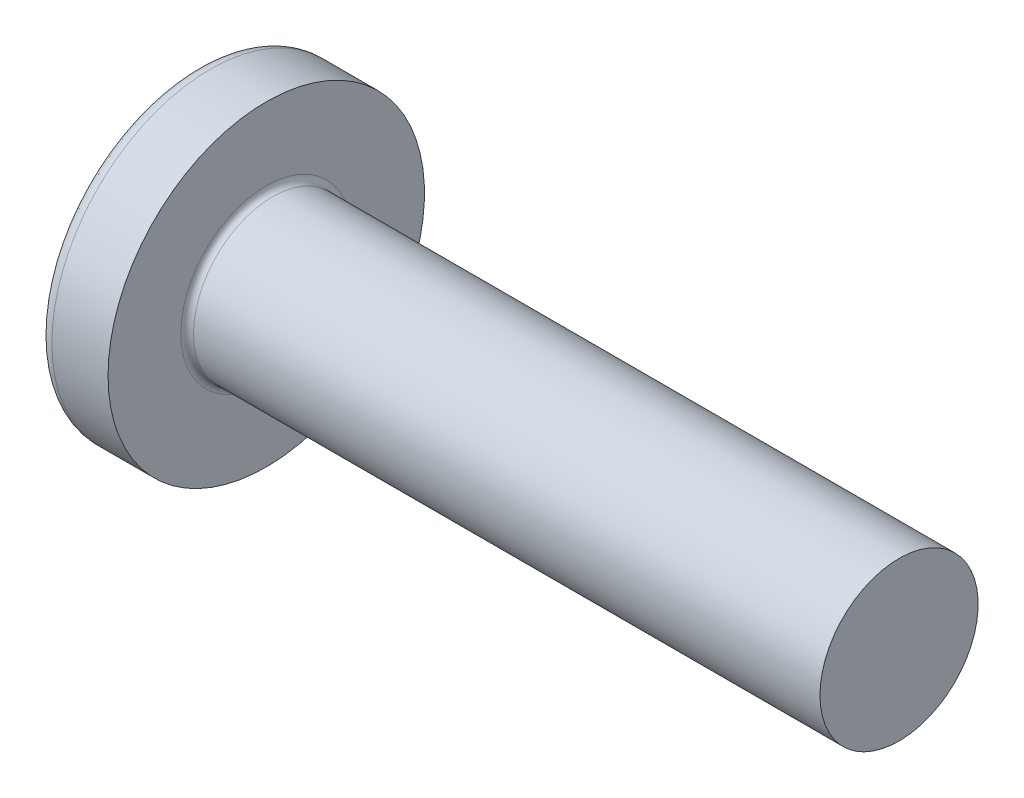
SolidWorks part; units mm, degrees
ref_plane "Plane1" through (0, 0, 0) normal (0, 0, 1) x (1, 0, 0)
ref_plane "Plane2" through (0, 0, 0) normal (0, 1, 0) x (1, 0, 0)
ref_plane "Plane3" through (0, 0, 0) normal (1, 0, 0) x (0, 0, -1)
revolve "Base-Revolve" add sketch "BodySke"
sketch "BodySke" plane through (0, 0, 0) normal (0, 0, 1) x (1, 0, 0)
  line L0 (7.5, 5) -> (7.5, 10)
  line L1 (8.25, 6.35) -> (8.25, -3.175) construction
  line L2 (-25.4, 0) -> (127, 0) construction
  line L3 (47.5, 0) -> (0, 0)
  line L4 (7.5, 5) -> (47.5, 5)
  line L5 (47.5, 5) -> (47.5, 0)
  line L6 (3.9501, 10) -> (7.5, 10)
  line L8 (7.5, 6.35) -> (7.5, -3.175) construction
  arc A0 (3.2319, 9.6424) -> (0, 0) centre (16, 0) ccw
  arc A2 (3.2319, 9.6424) -> (3.9501, 10) centre (3.9501, 9.1) cw
  dimension "Head_fillet_rad" = 0.9
  dimension "Head_crown_rad" = 16
  dimension "Head_ht" = 7.5
  dimension "Diameter" = 10
  dimension "Length" = 40
  dimension "Head_dia" = 20
  dimension "Advance" = 1.5
  dimension "Thread_nom" = 40
fillet "Fillet1" radius 0.4 1 edges at (7.5, 0, 5)
sketch "Sketch3" plane through (0, 0, 0) normal (1, 0, 0) x (0, 0, -1)
  line L0 (1.08, -4.95) -> (-1.08, -4.95)
  line L1 (1.08, -4.95) -> (1.08, 4.95)
  line L2 (-1.08, 4.95) -> (1.08, 4.95)
  line L3 (-1.08, 4.95) -> (-1.08, -4.95)
  dimension "D1" = 4.95
  dimension "Cross_dia" = 9.9
  dimension "D2" = 1.08
  dimension "Cross_width" = 2.16
ref_plane "Plane4" through (5.69, 0, 0) normal (1, 0, 0) x (0, 0, -1)
sketch "Sketch4" plane through (5.69, 0, 0) normal (1, 0, 0) x (0, 0, -1)
  line L0 (1.08, -2.1131) -> (-1.08, -2.1131)
  line L1 (1.08, -2.1131) -> (1.08, 2.1131)
  line L2 (-1.08, 2.1131) -> (1.08, 2.1131)
  line L3 (-1.08, 2.1131) -> (-1.08, -2.1131)
  dimension "D1" = 2.16
  dimension "D2" = 4.2261
  dimension "D3" = 1.08
  dimension "D4" = 2.1131
loft "Recess" cut profiles "Sketch3", "Sketch4"
pattern_circular "RecPat" count 2 every 90 about axis through (0, 0, 0) along (1, 0, 0) of "Recess"
sketch "RecCorSke" plane through (0, 0, 0) normal (0, 0, 1) x (1, 0, 0)
  line L0 (-3.175, 0) -> (15.875, 0) construction
  line L1 (-25.4, 0) -> (127, 0) construction
  line L2 (0, 0) -> (0, 2.3284)
  line L3 (0, 2.3284) -> (5.69, 1.9305)
  line L4 (5.69, 1.9305) -> (6.3173, 0)
  line L5 (6.3173, 0) -> (0, 0)
  dimension "Diameter" = 3.861
  dimension "Depth" = 5.69
  dimension "Draft_angle" = 4
  dimension "Bottom_angle" = 18
revolve "RecessCore" cut sketch "RecCorSke" angle 360 about L0
sketch "ThdSchSke" plane through (0, 0, 0) normal (0, 0, 1) x (1, 0, 0)
  line L0 (10.5, -4.172) -> (9.9202, -5)
  line L1 (10.5, -4.172) -> (11.0798, -5)
  line L2 (11.0798, -5) -> (11.0798, -6.25)
  line L3 (-3.175, 0) -> (5.1513, 0) construction
  line L5 (11.0798, -6.25) -> (9.9202, -6.25)
  line L6 (9.9202, -6.25) -> (9.9202, -5)
  dimension "Thread_minor" = 8.344
  dimension "Diameter" = 10
  dimension "Start" = 10.5
  dimension "SideAngle" = 55
  dimension "VeeAngle" = 70
  dimension "Overcut" = 12.5
revolve "ThreadSchematic" cut sketch "ThdSchSke" angle 360 about L3
pattern_linear "ThdSchPat"
equation "\"D1@Sketch3\" = \"Cross_dia@Sketch3\" / 2"
equation "\"D2@Sketch3\" = \"Cross_width@Sketch3\" / 2"
equation "\"Depth@RecCorSke\" = \"Cross_depth@Plane4\""
equation "\"D1@Sketch4\" = \"Cross_width@Sketch3\""
equation "\"D2@Sketch4\" = \"Cross_dia@Sketch3\" - 2.0 * \"Cross_depth@Plane4\" * tan(26.5  * 0.017453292)"
equation "\"D3@Sketch4\" = \"D1@Sketch4\" / 2"
equation "\"D4@Sketch4\" = \"D2@Sketch4\" / 2"
equation "\"Thread_length@ThreadCosmetic\" = ((sgn( (\"Length@BodySke\" - \"Advance@BodySke\" * 2.0 ) - \"Thread_nom@BodySke\" )-1)*( (\"Length@BodySke\" - \"Advance@BodySke\" * 2.0 ) - \"Thread_nom@BodySke\" ))/-2+ \"Thread_"
equation "\"Thread_minor@ThdSchSke\" = \"Thread_minor@ThreadCosmetic\""
equation "\"Diameter@ThdSchSke\" = \"Diameter@BodySke\""
equation "\"Overcut@ThdSchSke\" = \"Diameter@BodySke\" * 1.25"
equation "\"Start@ThdSchSke\" = \"Head_ht@BodySke\" + \"Length@BodySke\" - \"Thread_length@ThreadCosmetic\"  '---Non-countersunk---"
equation "\"Num_threads@ThdSchPat\" = int( \"Thread_length@ThreadCosmetic\" / \"Advance@BodySke\" + 0.999 )  + 1"
equation "\"Advance@ThdSchPat\" = \"Thread_length@ThreadCosmetic\" /  (\"Num_threads@ThdSchPat\" - 1) 'relax it"
